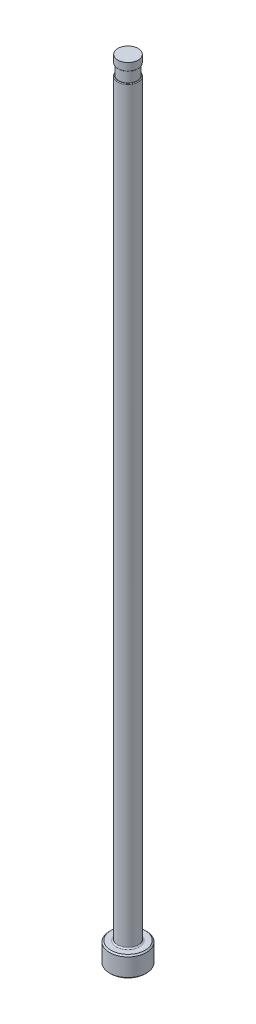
SolidWorks part; units mm, degrees
ref_plane "Front Plane" through (0, 0, 0) normal (0, 0, 1) x (1, 0, 0)
ref_plane "Top Plane" through (0, 0, 0) normal (0, 1, 0) x (1, 0, 0)
ref_plane "Right Plane" through (0, 0, 0) normal (1, 0, 0) x (0, 0, -1)
other "Configuration Table"
sketch "Sketch1" plane through (0, 0, 0) normal (0, 0, 1) x (1, 0, 0)
  line L0 (0, 259.9588) -> (0, -15.1925) construction
  line L1 (0, 0) -> (-3.5687, 0)
  line L2 (-3.5687, 0) -> (-3.5687, 3.9624)
  line L3 (-3.5687, 3.9624) -> (-1.9837, 3.9624)
  line L4 (-1.9837, 3.9624) -> (-1.9837, 152.4)
  line L5 (-1.9837, 152.4) -> (0, 152.4)
  line L6 (0, 152.4) -> (0, 0)
  dimension "L" = 152.4
  dimension "H" = 7.1374
  dimension "T" = 3.9624
  dimension "D" = 3.9675
revolve "Revolve1" add sketch "Sketch1" angle 360 about L0
chamfer "Chamfer1" distance 0.254 angle 45 2 edges at (0, 3.9624, 3.5687) (0, 0, 3.5687)
fillet "Fillet1" radius 0.254 1 edges at (0, 3.9624, 1.9837)
sketch "Sketch2" plane through (0, 0, 0) normal (0, 0, 1) x (1, 0, 0)
  line L0 (-1.9837, 152.4) -> (-1.9837, 4.2164) construction
  line L1 (-1.9837, 150.876) -> (-1.7805, 150.876)
  line L2 (-1.9837, 150.876) -> (-1.9837, 148.844)
  line L3 (-1.9837, 148.844) -> (-1.7805, 148.844)
  line L4 (-1.7805, 150.876) -> (-1.7805, 148.844)
  line L5 (1.9837, 152.4) -> (-1.9837, 152.4) construction
  line L6 (0, 153.4483) -> (0, 147.3282) construction
  dimension "D1" = 2.032
  dimension "N" = 1.524
  dimension "FD" = 0.2032
  dimension "D3" = 3.5611
revolve "Vent Relief" cut sketch "Sketch2" angle 360 about L6
sketch "Sketch3" plane through (0, 0, 0) normal (0, 0, 1) x (1, 0, 0)
  line L0 (-1.7805, 149.86) -> (-1.7805, 86.36)
  line L1 (-1.7805, 150.876) -> (-1.7805, 148.844) construction
  line L2 (-1.9837, 148.844) -> (-1.9837, 4.2164) construction
  line L3 (-1.9837, 85.2424) -> (-1.9837, 149.86)
  line L4 (-1.9837, 149.86) -> (-1.7805, 149.86)
  arc A0 (-1.7805, 86.36) -> (-1.9837, 85.2424) centre (-4.9555, 86.36) cw
  dimension "D1" = 3.175
  dimension "D2" = 63.5
extrude "D-Slot" cut sketch "Sketch3" against normal through all both and the other way through all
sketch "Sketch5" plane through (0, 0, 0) normal (0, 0, 1) x (1, 0, 0)
  line L0 (-1.9837, 150.876) -> (1.9837, 150.876) construction
  line L1 (-1.9837, 152.4) -> (-1.9583, 152.4)
  line L2 (-1.9837, 152.4) -> (-1.9837, 150.876)
  line L3 (-1.9837, 150.876) -> (-1.9583, 150.876)
  line L4 (-1.9583, 152.4) -> (-1.9583, 150.876)
  line L5 (0, 152.6877) -> (0, 150.5771) construction
  dimension "VP" = 0.0254
revolve "Vent Diameter" cut sketch "Sketch5" angle 360 about L5
fillet "Fillet2" radius 0.127 2 edges at (1.9837, 148.844, 0) (0, 150.876, 1.9583)
sketch "Pocket Sketch" plane through (0, 0, 0) normal (0, 0, 1) x (1, 0, 0)
  line L0 (-3.9656, 0) -> (-3.9656, 3.9878)
  line L1 (-3.9656, 3.9878) -> (-2.9442, 3.9878)
  line L2 (-2.1822, 4.7498) -> (-2.1822, 22.225)
  line L3 (-2.1822, 22.225) -> (0, 22.225)
  line L4 (0, 22.225) -> (0, 0)
  line L5 (0, 0) -> (-3.9656, 0)
  line L6 (0, 12.6104) -> (0, -2.4989) construction
  line L7 (-3.5687, 3.7084) -> (-3.5687, 0.254) construction
  line L8 (3.3147, 3.9624) -> (-3.3147, 3.9624) construction
  line L9 (-1.9837, 85.2424) -> (-1.9837, 4.2164) construction
  line L10 (-2.9442, 3.9878) -> (-2.1822, 4.7498)
  point P3 (-2.1822, 3.9878)
  dimension "D1" = 7.9311
  dimension "D2" = 0.3969
  dimension "D3" = 0.0254
  dimension "D4" = 0.1984
  dimension "D5" = 4.3644
  dimension "D6" = 22.225
